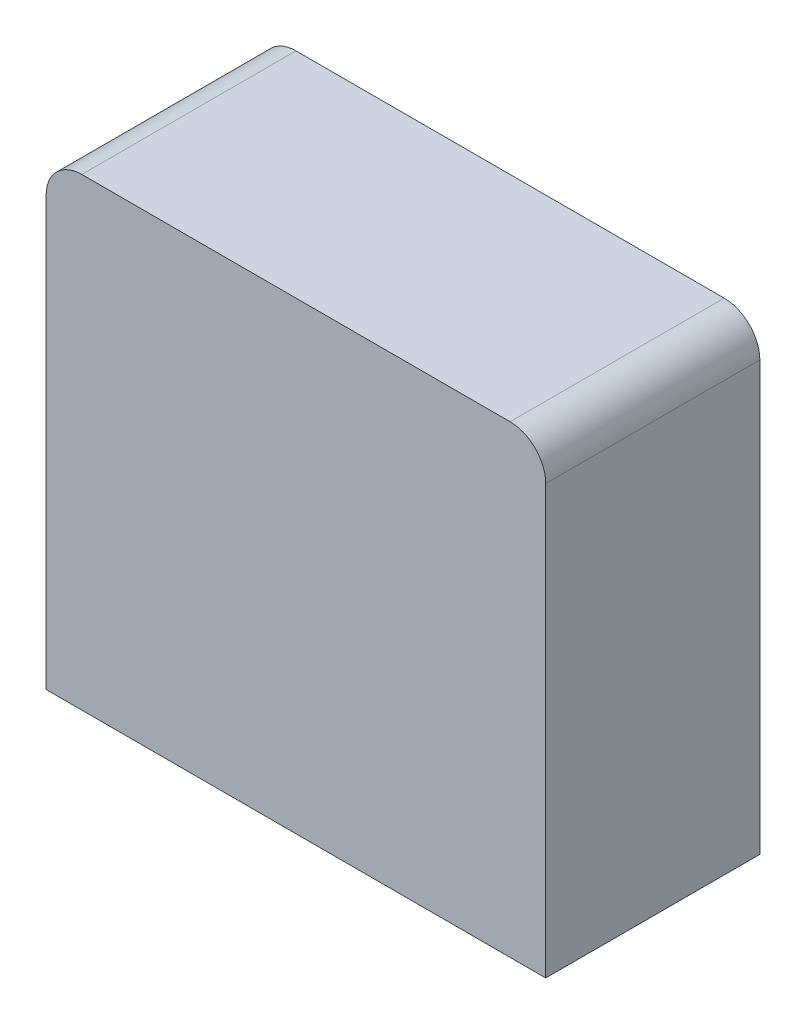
SolidWorks part; units mm, degrees
ref_plane "Front" through (0, 0, 0) normal (0, 0, 1) x (1, 0, 0)
ref_plane "Top" through (0, 0, 0) normal (0, 1, 0) x (1, 0, 0)
ref_plane "Right" through (0, 0, 0) normal (1, 0, 0) x (0, 0, -1)
sketch "草图1" plane through (0, 0, 0) normal (0, 1, 0) x (1, 0, 0)
  line L1 (0, 0) -> (14, 0)
  line L2 (0, 0) -> (0, 6)
  line L3 (0, 6) -> (14, 6)
  line L4 (14, 0) -> (14, 6)
  circle A0 centre (3, 3) radius 1.6
  circle A1 centre (11, 3) radius 1.6
  dimension "D1" = 3.2
  dimension "D2" = 3.2
  dimension "D3" = 14
  dimension "D4" = 6
  dimension "D5" = 3
  dimension "D6" = 3
  dimension "D7" = 3
  dimension "D8" = 3
extrude "凸台-拉伸1" add sketch "草图1" along normal blind 10
sketch "草图2" plane through (0, 10, 0) normal (0, 1, 0) x (1, 0, 0)
  line L0 (0, 6) -> (0, 0) construction
  line L1 (0, 0) -> (14, 0) construction
  line L2 (14, 0) -> (14, 6) construction
  line L3 (14, 6) -> (0, 6) construction
  line L4 (0, 6) -> (0, 0)
  line L5 (0, 0) -> (14, 0)
  line L6 (14, 0) -> (14, 6)
  line L7 (14, 6) -> (0, 6)
extrude "凸台-拉伸2" add sketch "草图2" along normal blind 3
fillet "圆角1" radius 1 2 edges at (14, 13, -3) (0, 13, -3)
